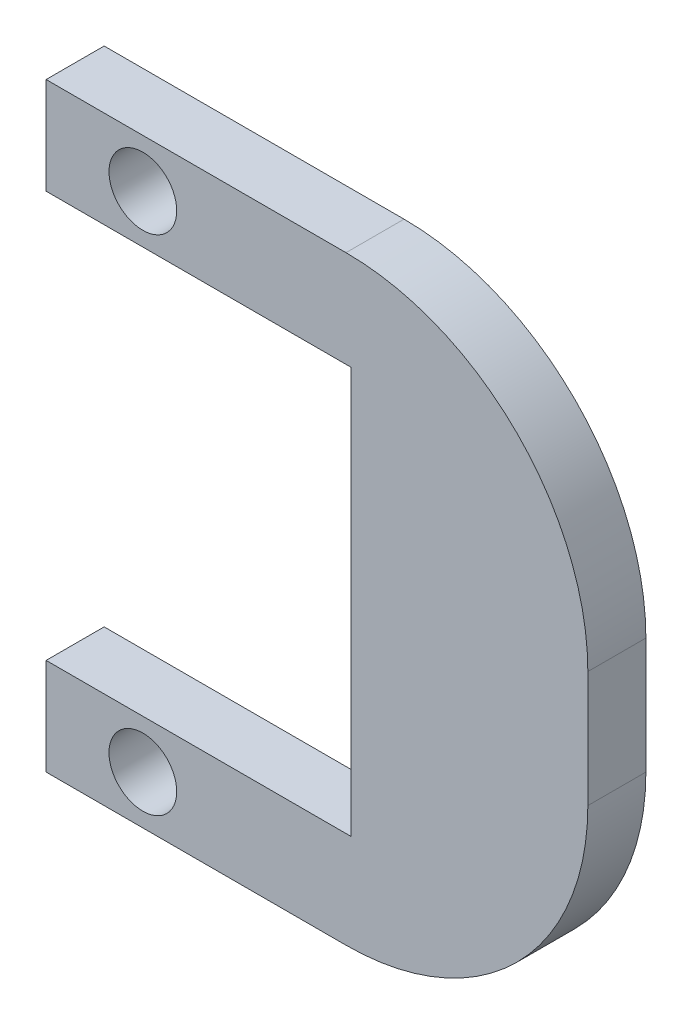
SolidWorks part; units mm, degrees
ref_plane "Front Plane" through (0, 0, 0) normal (0, 0, 1) x (1, 0, 0)
ref_plane "Top Plane" through (0, 0, 0) normal (0, 1, 0) x (1, 0, 0)
ref_plane "Right Plane" through (0, 0, 0) normal (1, 0, 0) x (0, 0, -1)
sketch "Sketch1" plane through (0, 0, 0) normal (0, 0, 1) x (1, 0, 0)
  line L0 (0, -1000) -> (0, 49000) construction
  line L1 (-28, 31) -> (3, 31)
  line L2 (-28, 31) -> (-28, 21)
  line L3 (-28, -31) -> (3, -31)
  line L4 (28, 6) -> (28, -6)
  line L5 (-28, 31) -> (28, -31) construction
  line L6 (-28, -31) -> (28, 31) construction
  line L7 (-1000, 0) -> (49000, 0) construction
  line L8 (-18, -99.2327) -> (-18, 37.2327) construction
  line L9 (-28, 21) -> (3.5, 21)
  line L10 (13.5, -99.6877) -> (13.5, 37.6877) construction
  line L11 (-28, -21) -> (3.5, -21)
  line L12 (3.5, 21) -> (3.5, -21)
  line L13 (-102.775, 26) -> (46.775, 26) construction
  line L14 (-28, -21) -> (-28, -31)
  circle A0 centre (-18, 26) radius 3.5
  circle A1 centre (-18, -26) radius 3.5
  arc A2 (3, -31) -> (28, -6) centre (3, -6) ccw
  arc A3 (3, 31) -> (28, 6) centre (3, 6) cw
  point P0 (0, 0)
  point P17 (-18, -31)
  point P20 (-28, 26)
  point P27 (13.5, -31)
  dimension "D7" = 7
  dimension "D9" = 25
  dimension "D1" = 62
  dimension "D2" = 56
  dimension "D3" = 31.5
  dimension "D4" = 42
  dimension "D5" = 21.5
  dimension "D6" = 5
  dimension "D8" = 10
extrude "Boss-Extrude1" add sketch "Sketch1" along normal blind 6
